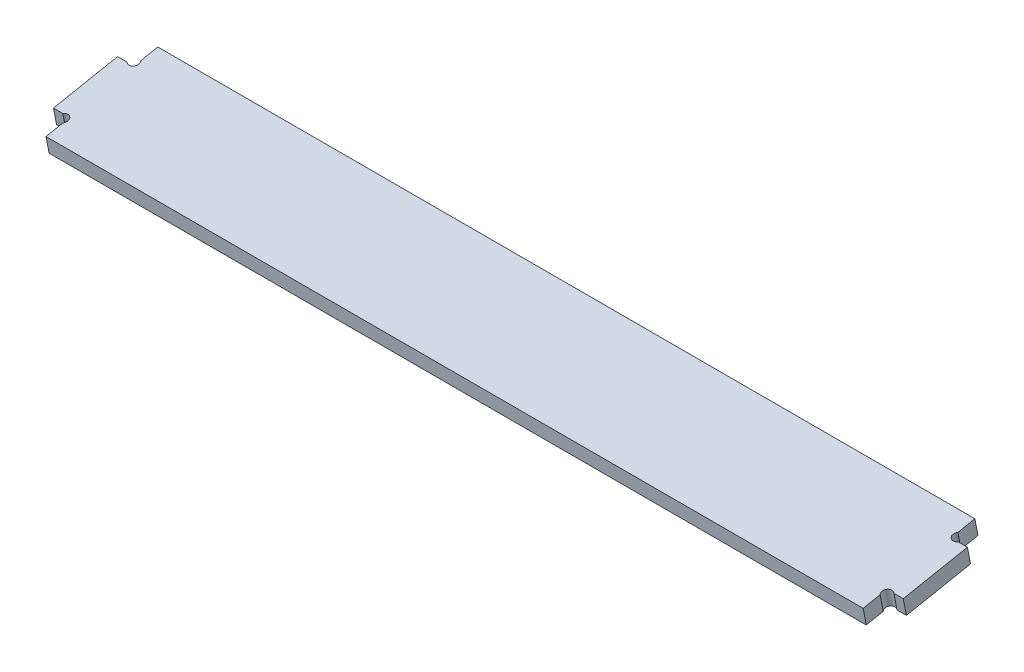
SolidWorks part; units mm, degrees
ref_plane "Alzado" through (0, 0, 0) normal (0, 0, 1) x (1, 0, 0)
ref_plane "Planta" through (0, 0, 0) normal (0, 1, 0) x (1, 0, 0)
ref_plane "Vista lateral" through (0, 0, 0) normal (1, 0, 0) x (0, 0, -1)
sketch "Croquis3" plane through (-500, 0, 0) normal (1, 0, 0) x (0, 0, -1)
  line L0 (10, 494.1528) -> (78.3838, 507.4268)
  line L1 (10, 494.1528) -> (8.0945, 503.9696)
  line L2 (78.3838, 507.4268) -> (76.4783, 517.2436)
  line L3 (8.0945, 503.9696) -> (76.4783, 517.2436)
  line L4 (71.8307, 597.6788) -> (87.3264, 517.8497) construction
  dimension "D1" = 10
extrude "Saliente-Extruir2" add sketch "Croquis3" along normal up to surface (500 mm away)
sketch "Croquis4" plane through (0, 484.1558, 93.9799) normal (0, 0.9817, 0.1906) x (1, 0, 0)
  line L0 (-500, 138.8097) -> (0, 138.8097) construction
  line L1 (-500, 173.6398) -> (-500, 103.9796) construction
  line L2 (0, 103.9796) -> (0, 173.6398) construction
  line L3 (-500, 158.8097) -> (-500, 118.8097)
  line L4 (-500, 158.8097) -> (-510, 158.8097)
  line L5 (-500, 118.8097) -> (-510, 118.8097)
  line L6 (-510, 158.8097) -> (-510, 118.8097)
  point P6 (-500, 138.8097)
  dimension "D1" = 10
  dimension "D2" = 40
extrude "Saliente-Extruir3" add sketch "Croquis4" against normal blind 10
sketch "Croquis5" plane through (0, 484.1558, 93.9799) normal (0, 0.9817, 0.1906) x (1, 0, 0)
  line L0 (-502.1213, 160.931) -> (-500, 160.931) construction
  line L1 (-500, 173.6398) -> (-500, 158.8097) construction
  line L2 (-502.1213, 160.931) -> (-502.1213, 158.8097) construction
  line L3 (-500, 158.8097) -> (-510, 158.8097) construction
  line L4 (-510, 138.8097) -> (-482.5244, 138.8097) construction
  line L5 (-510, 158.8097) -> (-510, 118.8097) construction
  line L6 (-502.1213, 116.6884) -> (-502.1213, 118.8097) construction
  line L7 (-502.1213, 116.6884) -> (-500, 116.6884) construction
  circle A0 centre (-502.1213, 160.931) radius 3
  circle A1 centre (-502.1213, 116.6884) radius 3
  dimension "D1" = 6
extrude "Cortar-Extruir1" cut sketch "Croquis5" against normal through all both and the other way through all
ref_plane "Plano1" through (-250, 0, 0) normal (-1, 0, 0) x (0, 0, 1)
mirror "Simetría1" about plane through (-250, 0, 0) normal (-1, 0, 0) of "Saliente-Extruir3", "Cortar-Extruir1"
